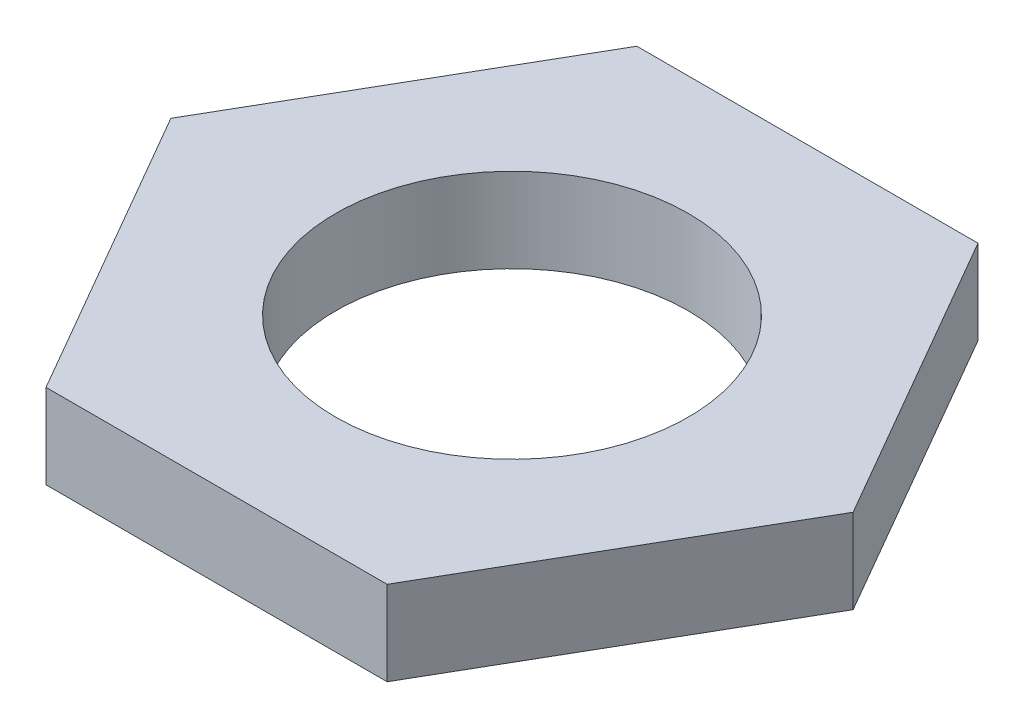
SolidWorks part; units mm, degrees
ref_plane "Front Plane" through (0, 0, 0) normal (0, 0, 1) x (1, 0, 0)
ref_plane "Top Plane" through (0, 0, 0) normal (0, 1, 0) x (1, 0, 0)
ref_plane "Right Plane" through (0, 0, 0) normal (1, 0, 0) x (0, 0, -1)
sketch "Sketch1" plane through (0, 0, 0) normal (0, 1, 0) x (1, 0, 0)
  line L1 (3.0796, 0) -> (1.5398, 2.667)
  line L2 (1.5398, 2.667) -> (-1.5398, 2.667)
  line L3 (-1.5398, 2.667) -> (-3.0796, 0)
  line L4 (-3.0796, 0) -> (-1.5398, -2.667)
  line L5 (-1.5398, -2.667) -> (1.5398, -2.667)
  line L6 (1.5398, -2.667) -> (3.0796, 0)
  circle A0 centre (0, 0) radius 2.667 construction
  circle A1 centre (0, 0) radius 1.5926
extrude "Boss-Extrude1" add sketch "Sketch1" along normal blind 0.762
